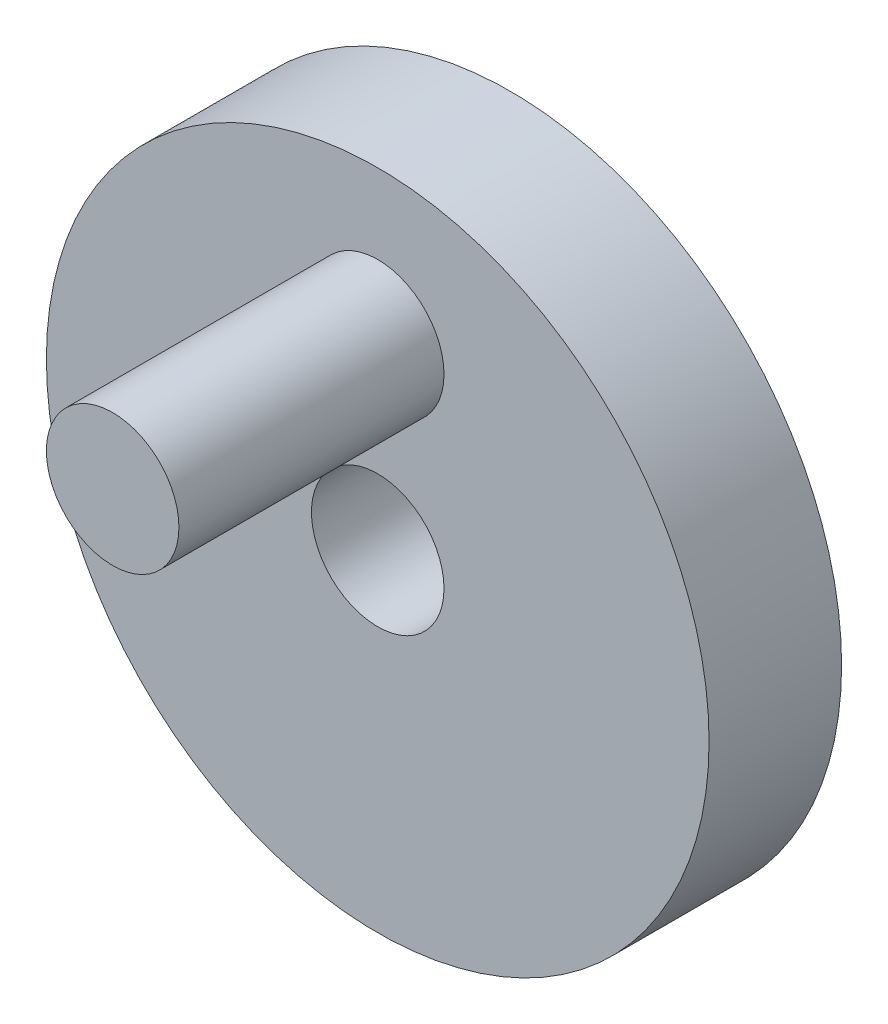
SolidWorks part; units mm, degrees
ref_plane "Front Plane" through (0, 0, 0) normal (0, 0, 1) x (1, 0, 0)
ref_plane "Top Plane" through (0, 0, 0) normal (0, 1, 0) x (1, 0, 0)
ref_plane "Right Plane" through (0, 0, 0) normal (1, 0, 0) x (0, 0, -1)
sketch "Sketch1" plane through (0, 0, 0) normal (0, 0, 1) x (1, 0, 0)
  circle A0 centre (0, 0) radius 25
  dimension "D1" = 50
extrude "Boss-Extrude1" add sketch "Sketch1" along normal blind 10
sketch "Sketch2" plane through (0, 0, 10) normal (0, 0, 1) x (1, 0, 0)
  circle A0 centre (0, 0) radius 5
  circle A1 centre (0, 0) radius 25 construction
  dimension "D1" = 10
extrude "Cut-Extrude1" cut sketch "Sketch2" against normal blind 10
sketch "Sketch3" plane through (0, 0, 10) normal (0, 0, 1) x (1, 0, 0)
  line L0 (0, 0) -> (0, 33.3439) construction
  circle A0 centre (0, 14) radius 5
  circle A1 centre (0, 0) radius 25 construction
  dimension "D1" = 10
  dimension "D2" = 14
extrude "Boss-Extrude2" add sketch "Sketch3" along normal blind 20
